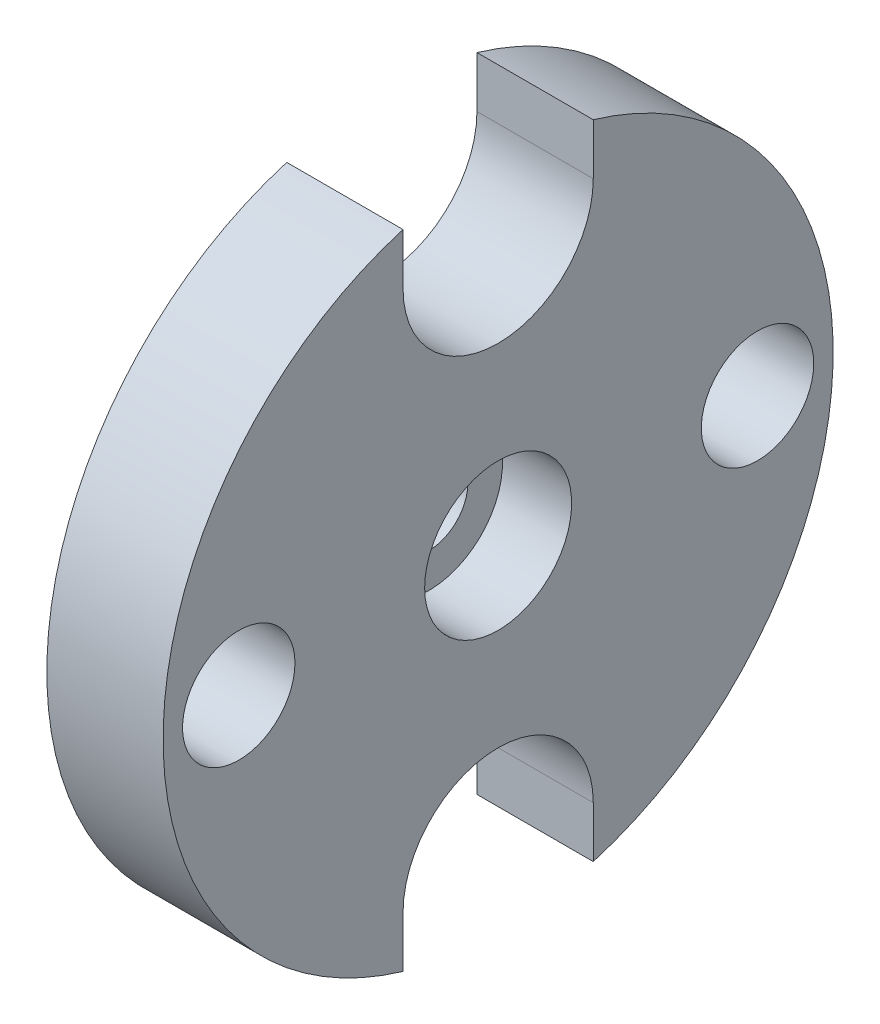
SolidWorks part; units mm, degrees
ref_plane "Vorne" through (0, 0, 0) normal (0, 0, 1) x (1, 0, 0)
ref_plane "Oben" through (0, 0, 0) normal (0, 1, 0) x (1, 0, 0)
ref_plane "Rechts" through (0, 0, 0) normal (1, 0, 0) x (0, 0, -1)
sketch "Skizze1" plane through (0, 0, 0) normal (0, 0, 1) x (1, 0, 0)
  line L0 (0, 0) -> (79.1682, 0) construction
  line L1 (2.69, 7.75) -> (2.69, 0) construction
  line L3 (0, 7.75) -> (2.69, 7.75) construction
  line L4 (0, 0) -> (0, 7.75) construction
  line L5 (0, 0) -> (79.1682, 0) construction
  line L6 (2.69, 7.75) -> (2.69, 0)
  line L8 (0, 7.75) -> (2.69, 7.75)
  line L9 (0, 0) -> (0, 7.75)
  line L10 (0, 0) -> (2.69, 0)
revolve "Rotation1" add sketch "Skizze1" angle 360 about L5
sketch "Skizze2" plane through (0, 0, 0) normal (0, 0, 1) x (1, 0, 0)
  line L0 (0, 0) -> (2.69, 0) construction
  line L1 (0, 7.75) -> (0, -7.75) construction
  line L3 (2.69, 1.7) -> (1.09, 1.7)
  line L4 (1.09, 1.7) -> (1.09, 0.9)
  line L5 (1.09, 0.9) -> (0.29, 0.9)
  line L6 (0.29, 0.9) -> (0.29, 0)
  line L7 (2.69, 0) -> (0.29, 0)
  line L8 (2.69, 0) -> (2.69, 1.7)
  line L10 (2.69, -7.75) -> (2.69, 7.75) construction
  dimension "D1" = 3.4
  dimension "D2" = 1.8
  dimension "D3" = 1.6
  dimension "D4" = 2.4
revolve "Schnitt-Rotation1" cut sketch "Skizze2" angle 360 about L0
hole_wizard "Ø0.34 (0.35) Durchmesser Bohrung1" positions "Skizze5" profile "Skizze4" hole size "Ø0.3" standard "ISO"
sketch "Skizze5" plane through (0.29, 0, 0) normal (1, 0, 0) x (0, 0, -1)
  point P0 (0, 0.28)
  point P1 (0, -0.28)
  dimension "D1" = 0.28
  dimension "D2" = 0.28
sketch "Skizze4" plane through (0.29, 0.28, 0) normal (0, 1, 0) x (0, 0, -1)
  line L0 (0, 0) -> (0, 0.29)
  line L1 (0, 0.29) -> (0.15, 0.29)
  line L2 (0.15, 0.29) -> (0.15, 0)
  line L5 (0.15, 0) -> (0, 0)
  line L11 (0, -6.35) -> (0, 107.95) construction
  dimension "Bohrerdurchmesser" = 0.3
  dimension "Bohrungstiefe" = 0.29
hole_wizard "Ø2.6 (2.6) Durchmesser Bohrung1" positions "Skizze7" profile "Skizze6" hole size "Ø2.6" standard "ISO"
sketch "Skizze7" plane through (2.69, 3.7269, 0.4471) normal (1, 0, 0) x (0, 0, -1)
  point P0 (6.4471, -3.7269)
  point P1 (-5.5529, -3.7269)
  dimension "D1" = 12
  dimension "D2" = 6
sketch "Skizze6" plane through (2.69, 0, -6) normal (0, 1, 0) x (0, 0, -1)
  line L0 (0, 0) -> (0, 2.69)
  line L1 (0, 2.69) -> (1.3, 2.69)
  line L2 (1.3, 2.69) -> (1.3, 0)
  line L5 (1.3, 0) -> (0, 0)
  line L11 (0, -6.35) -> (0, 107.95) construction
  dimension "Bohrerdurchmesser" = 2.6
  dimension "Bohrungstiefe" = 2.69
sketch "Skizze8" plane through (2.69, 0, 0) normal (1, 0, 0) x (0, 0, -1)
  line L0 (-2.6538, 0) -> (3.0161, 0) construction
  line L1 (-2.2, 7.75) -> (2.2, 7.75)
  line L2 (-2.2, 7.75) -> (-2.2, 6.25)
  line L3 (2.2, -7.75) -> (2.2, -6.25)
  line L4 (2.2, 7.75) -> (2.2, 6.25)
  line L5 (-2.2, -7.75) -> (2.2, -7.75)
  line L6 (-2.2, -7.75) -> (-2.2, -6.25)
  arc A0 (-2.2, 6.25) -> (2.2, 6.25) centre (0, 6.25) ccw
  arc A2 (-2.2, -6.25) -> (2.2, -6.25) centre (0, -6.25) cw
  circle A3 centre (0, 0) radius 7.75 construction
  dimension "D1" = 2.2
  dimension "D2" = 6.25
extrude "Linear austragen1" cut sketch "Skizze8" against normal through all
